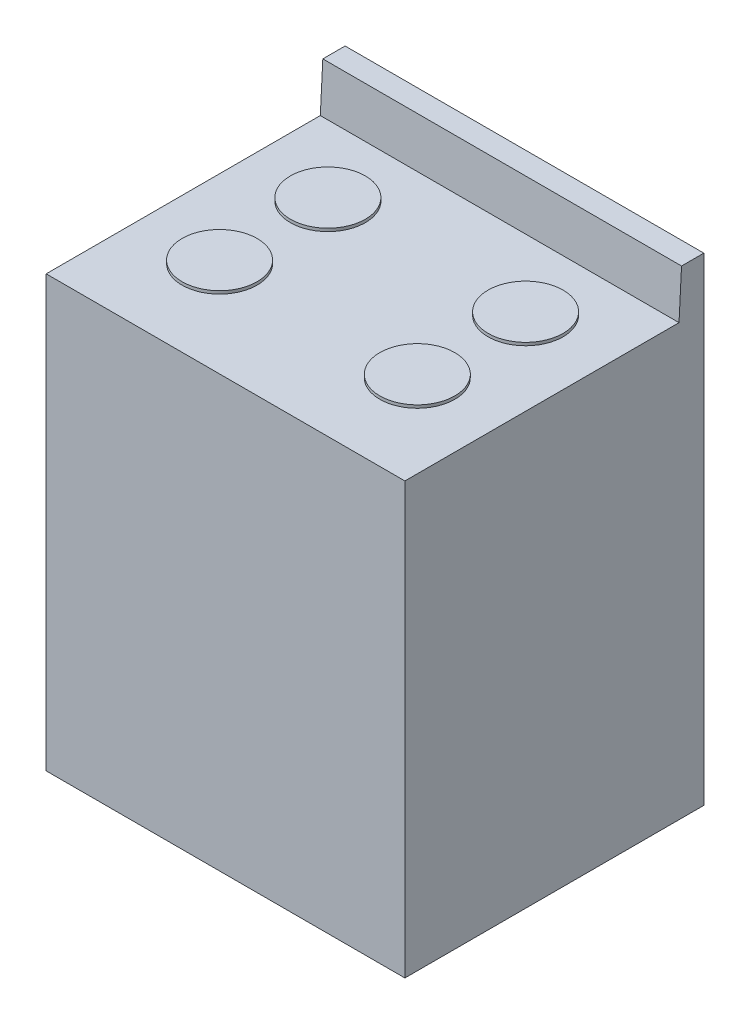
SolidWorks part; units mm, degrees
ref_plane "Front Plane" through (0, 0, 0) normal (0, 0, 1) x (1, 0, 0)
ref_plane "Top Plane" through (0, 0, 0) normal (0, 1, 0) x (1, 0, 0)
ref_plane "Right Plane" through (0, 0, 0) normal (1, 0, 0) x (0, 0, -1)
sketch "Sketch1" plane through (0, 0, 0) normal (0, 0, 1) x (1, 0, 0)
  line L1 (-37.6059, 26.8823) -> (724.3941, 26.8823)
  line L2 (-37.6059, 26.8823) -> (-37.6059, -887.5177)
  line L3 (-37.6059, -887.5177) -> (724.3941, -887.5177)
  line L4 (724.3941, 26.8823) -> (724.3941, -887.5177)
  dimension "D1" = 762
  dimension "D2" = 914.4
extrude "Boss-Extrude1" add sketch "Sketch1" along normal blind 635
sketch "Sketch2" plane through (0, 26.8823, 0) normal (0, 1, 0) x (1, 0, 0)
  line L0 (724.3941, -635) -> (724.3941, 0) construction
  line L1 (-37.6059, 0) -> (724.3941, 0)
  line L2 (-37.6059, 0) -> (-37.6059, -47.3667)
  line L3 (-37.6059, -47.3667) -> (724.3941, -47.3667)
  line L4 (724.3941, 0) -> (724.3941, -47.3667)
extrude "Boss-Extrude2" add sketch "Sketch2" along normal blind 101.6
draft "Draft1" type of draft neutral plane draft angle 3 faces to draft 1 parameters "D1"=3
sketch "Sketch3" plane through (0, 26.8823, 0) normal (0, 1, 0) x (1, 0, 0)
  circle A0 centre (127.6593, -201.8909) radius 79.6749
extrude "Boss-Extrude3" add sketch "Sketch3" along normal blind 6.35
pattern_linear "LPattern1" count 2 spacing 420 along (1, 0, 0) count 2 spacing 230 along (0, 0, 1) of "Boss-Extrude3"
